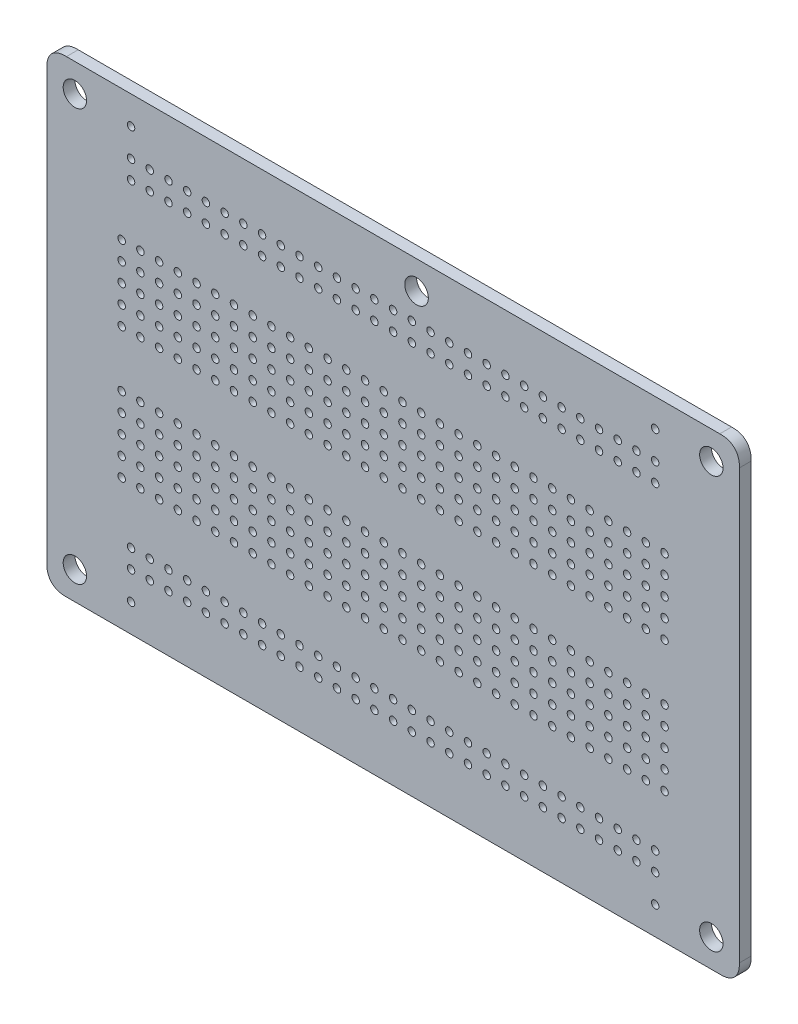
SolidWorks part; units mm, degrees
ref_plane "Front Plane" through (0, 0, 0) normal (0, 0, 1) x (1, 0, 0)
ref_plane "Top Plane" through (0, 0, 0) normal (0, 1, 0) x (1, 0, 0)
ref_plane "Right Plane" through (0, 0, 0) normal (1, 0, 0) x (0, 0, -1)
imported_body "Sparkfun Protoboard"
sketch "Sketch1" plane through (0, 0, 0.8001) normal (0, 0, 1) x (1, 0, 0)
  line L0 (90.17, 59.69) -> (50.17, 59.69) construction
  circle A0 centre (50.17, 59.69) radius 1.6
  point P2 (0, 0)
  point P5 (0, 0)
  dimension "D1" = 3.2
  dimension "D2" = 40
extrude "Cut-Extrude2" cut sketch "Sketch1" against normal through all
